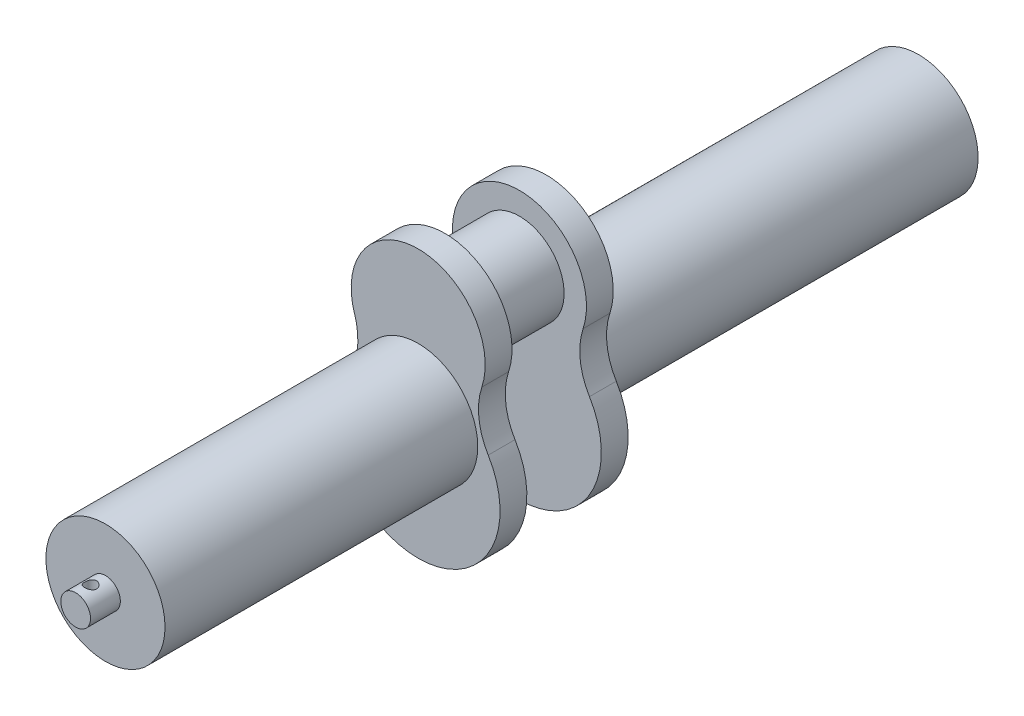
SolidWorks part; units mm, degrees
ref_plane "Płaszczyzna przednia" through (0, 0, 0) normal (0, 0, 1) x (1, 0, 0)
ref_plane "Płaszczyzna górna" through (0, 0, 0) normal (0, 1, 0) x (1, 0, 0)
ref_plane "Płaszczyzna prawa" through (0, 0, 0) normal (1, 0, 0) x (0, 0, -1)
sketch "Szkic1" plane through (0, 0, 0) normal (0, 0, 1) x (1, 0, 0)
  line L0 (0, 0) -> (0, 50) construction
  circle A0 centre (0, 50) radius 30
  dimension "D1" = 60
  dimension "D2" = 50
extrude "Dodanie-wyciągnięcie1" add sketch "Szkic1" along normal mid plane 50
sketch "Szkic2" plane through (0, 0, 25) normal (0, 0, 1) x (1, 0, 0)
  line L0 (0, -30) -> (0, 72.0201) construction
  arc A0 (42.7463, 35.9375) -> (-42.7463, 35.9375) centre (0, 50) ccw
  arc A1 (-47.0209, -1.4688) -> (47.0209, -1.4688) centre (0, -30) ccw
  arc A2 (-47.0209, -1.4688) -> (-42.7463, 35.9375) centre (-85.4926, 21.875) ccw
  arc A3 (47.0209, -1.4688) -> (42.7463, 35.9375) centre (85.4926, 21.875) cw
  dimension "D1" = 90
  dimension "D2" = 110
  dimension "D4" = 45
  dimension "D3" = 80
extrude "Dodanie-wyciągnięcie2" add sketch "Szkic2" along normal blind 18
sketch "Szkic3" plane through (0, 0, 43) normal (0, 0, 1) x (1, 0, 0)
  circle A0 centre (0, 0) radius 40
  dimension "D1" = 80
extrude "Dodanie-wyciągnięcie3" add sketch "Szkic3" along normal blind 210
mirror "Lustro2" about plane through (0, 0, 0) normal (0, 0, 1) of "Dodanie-wyciągnięcie2"
sketch "Szkic4" plane through (0, 0, -43) normal (0, 0, -1) x (-1, 0, 0)
  circle A0 centre (0, 0) radius 40
  dimension "D1" = 80
extrude "Dodanie-wyciągnięcie4" add sketch "Szkic4" along normal blind 250
sketch "Szkic5" plane through (0, 0, 253) normal (0, 0, 1) x (1, 0, 0)
  circle A0 centre (0, 0) radius 10
  dimension "D1" = 20
extrude "Dodanie-wyciągnięcie5" add sketch "Szkic5" along normal blind 20
sketch "Szkic6" plane through (0, 0, 0) normal (0, 1, 0) x (1, 0, 0)
  line L0 (-10, -273) -> (10, -273) construction
  circle A0 centre (0, -263) radius 4
  dimension "D1" = 8
  dimension "D2" = 10
extrude "Wytnij-wyciągnięcie1" cut sketch "Szkic6" against normal up to next and the other way up to next
